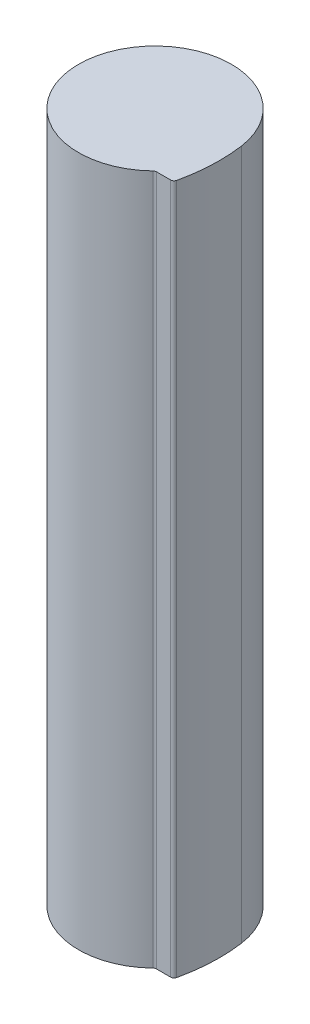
SolidWorks part; units mm, degrees
ref_plane "Alzado" through (0, 0, 0) normal (0, 0, 1) x (1, 0, 0)
ref_plane "Planta" through (0, 0, 0) normal (0, 1, 0) x (1, 0, 0)
ref_plane "Vista lateral" through (0, 0, 0) normal (1, 0, 0) x (0, 0, -1)
sketch "Sketch1" plane through (0, 0, 0) normal (0, 1, 0) x (1, 0, 0)
  line L0 (4.7, -4.7045) -> (6.3, -4.7045)
  arc A0 (6.5873, 0.911) -> (4.7, -4.7045) centre (0, 0) ccw
  arc A1 (6.3, -4.7045) -> (6.5873, 0.911) centre (-8.2713, -1.1439) ccw
  dimension "D1" = 13.3
  dimension "D4" = 30
  dimension "D2" = 4.7
  dimension "D3" = 6.3
extrude "Boss-Extrude1" add sketch "Sketch1" along normal blind 60
fillet "Fillet1" radius 0.3 2 edges at (6.3, 30, 4.7045) (4.7, 30, 4.7045)
